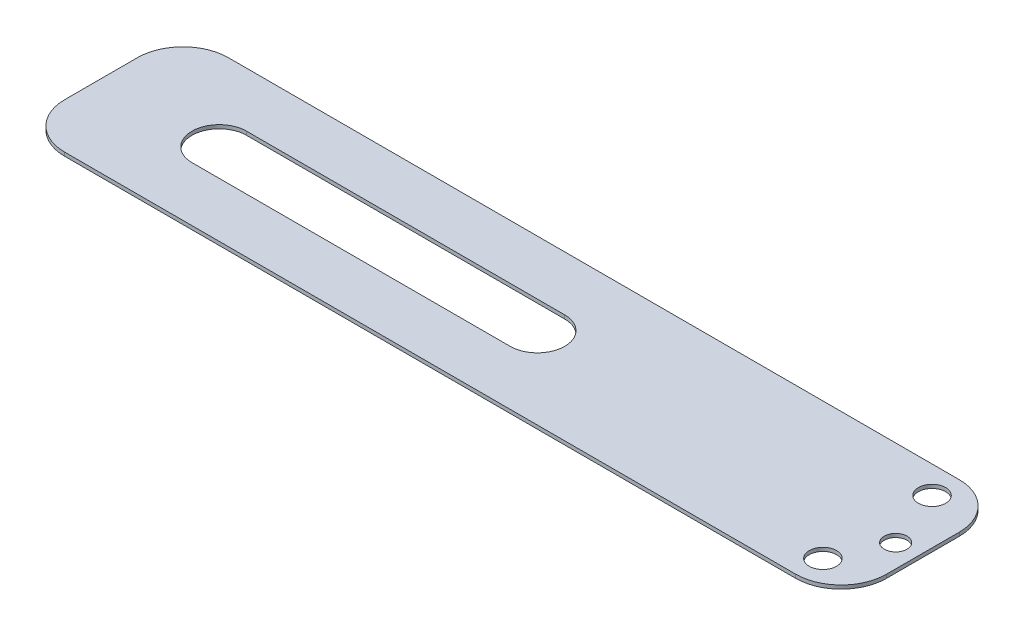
SolidWorks part; units mm, degrees
ref_plane "Front Plane" through (0, 0, 0) normal (0, 0, 1) x (1, 0, 0)
ref_plane "Top Plane" through (0, 0, 0) normal (0, 1, 0) x (1, 0, 0)
ref_plane "Right Plane" through (0, 0, 0) normal (1, 0, 0) x (0, 0, -1)
sketch "Sketch1" plane through (0, 0, 0) normal (0, 1, 0) x (1, 0, 0)
  line L1 (-90.4, -18) -> (0, -18)
  line L2 (-90.4, -18) -> (-90.4, 0)
  line L3 (-90.4, 0) -> (0, 0)
  line L4 (0, -18) -> (0, 0)
  dimension "D1" = 90.4
  dimension "D2" = 18
extrude "Boss-Extrude1" add sketch "Sketch1" along normal blind 0.4
sketch "Sketch2" plane through (0, 0.4, 0) normal (0, 1, 0) x (1, 0, 0)
  line L0 (-90.4, -18) -> (0, -18) construction
  line L1 (-77.4, -12) -> (-42.4, -12)
  line L2 (-90.4, 0) -> (-90.4, -18) construction
  line L3 (-77.4, -6) -> (-42.4, -6)
  line L5 (0, 0) -> (-90.4, 0) construction
  line L6 (0, -18) -> (0, 0) construction
  line L7 (0, 0) -> (-90.4, 0) construction
  circle A0 centre (-5, -3) radius 1.5
  circle A1 centre (-5, -15) radius 1.5
  circle A2 centre (-2.5, -9.5) radius 1.25
  arc A3 (-77.4, -6) -> (-77.4, -12) centre (-77.4, -9) ccw
  arc A4 (-42.4, -12) -> (-42.4, -6) centre (-42.4, -9) ccw
  dimension "D5" = 3
  dimension "D6" = 2.5
  dimension "D9" = 3
  dimension "D1" = 12
  dimension "D2" = 3
  dimension "D3" = 5
  dimension "D4" = 15
  dimension "D7" = 2.5
  dimension "D8" = 6
  dimension "D10" = 13
  dimension "D11" = 35
  dimension "D12" = 8.5
  dimension "D13" = 9
  dimension "D14" = 9
extrude "Cut-Extrude1" cut sketch "Sketch2" against normal through all
fillet "Fillet1" radius 5 2 edges at (-90.4, 0.2, 0) (-90.4, 0.2, 18)
fillet "Fillet4" radius 5 1 edges at (0, 0.2, 0)
fillet "Fillet6" radius 5 1 edges at (0, 0.2, 18)
